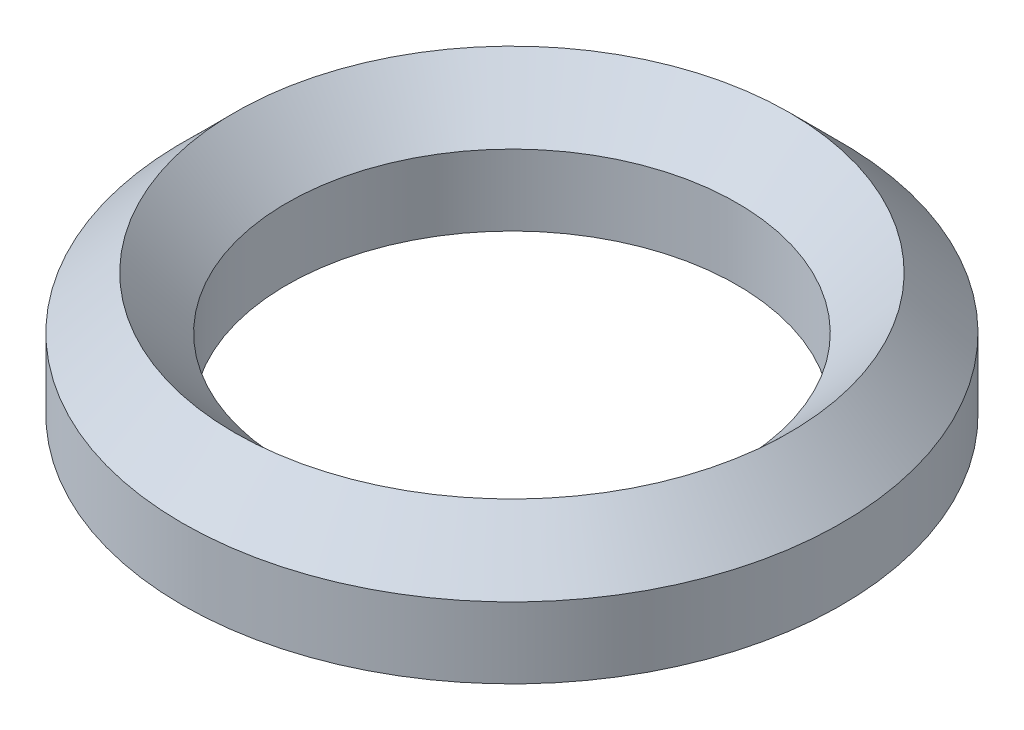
SolidWorks part; units mm, degrees
ref_plane "前基準面" through (0, 0, 0) normal (0, 0, 1) x (1, 0, 0)
ref_plane "上基準面" through (0, 0, 0) normal (0, 1, 0) x (1, 0, 0)
ref_plane "右基準面" through (0, 0, 0) normal (1, 0, 0) x (0, 0, -1)
sketch "草圖2" plane through (0, 0, 0) normal (1, 0, 0) x (0, 0, -1)
  line L0 (0, 3.3191) -> (0, -3.3191) construction
  line L1 (11.1, -6.075) -> (13.675, -3.5)
  line L3 (11.1, -2.575) -> (11.1, -6.075)
  line L4 (13.675, 0) -> (11.1, -2.575)
  line L5 (16.25, -2.575) -> (16.25, -6.075)
  line L6 (13.675, -3.5) -> (16.25, -6.075)
  line L7 (13.675, 0) -> (16.25, -2.575)
  dimension "D1" = 22.2
  dimension "D2" = 32.5
  dimension "D3" = 3.5
  dimension "D4" = 45
revolve "旋轉1" add sketch "草圖2" angle 360 about L0
